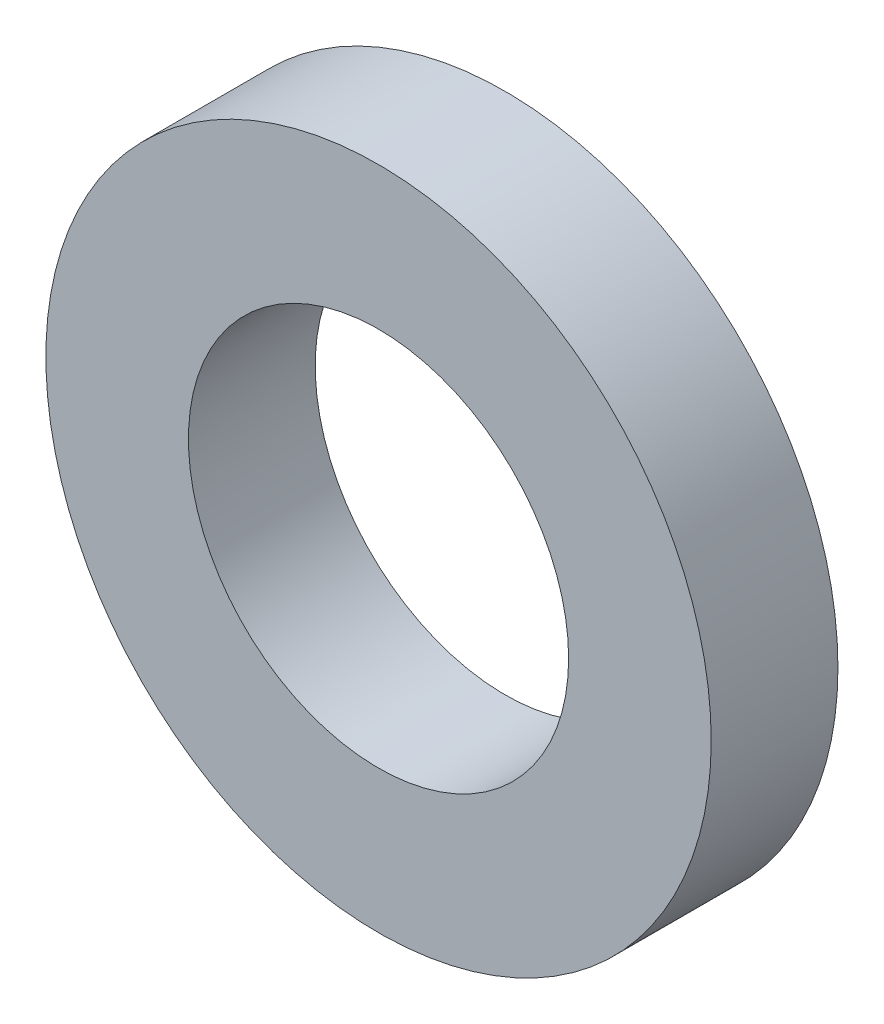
SolidWorks part; units mm, degrees
ref_plane "Front Plane" through (0, 0, 0) normal (0, 0, 1) x (1, 0, 0)
ref_plane "Top Plane" through (0, 0, 0) normal (0, 1, 0) x (1, 0, 0)
ref_plane "Right Plane" through (0, 0, 0) normal (1, 0, 0) x (0, 0, -1)
sketch "Sketch1" plane through (0, 0, 0) normal (0, 0, 1) x (1, 0, 0)
  circle A0 centre (0, 0) radius 4
  circle A1 centre (0, 0) radius 5.75
  dimension "D1" = 8
  dimension "D2" = 11.5
extrude "Boss-Extrude1" add sketch "Sketch1" along normal blind 2
other "Move Face1" parameters "D1"=0.5
other "Move Face2" parameters "D1"=1
